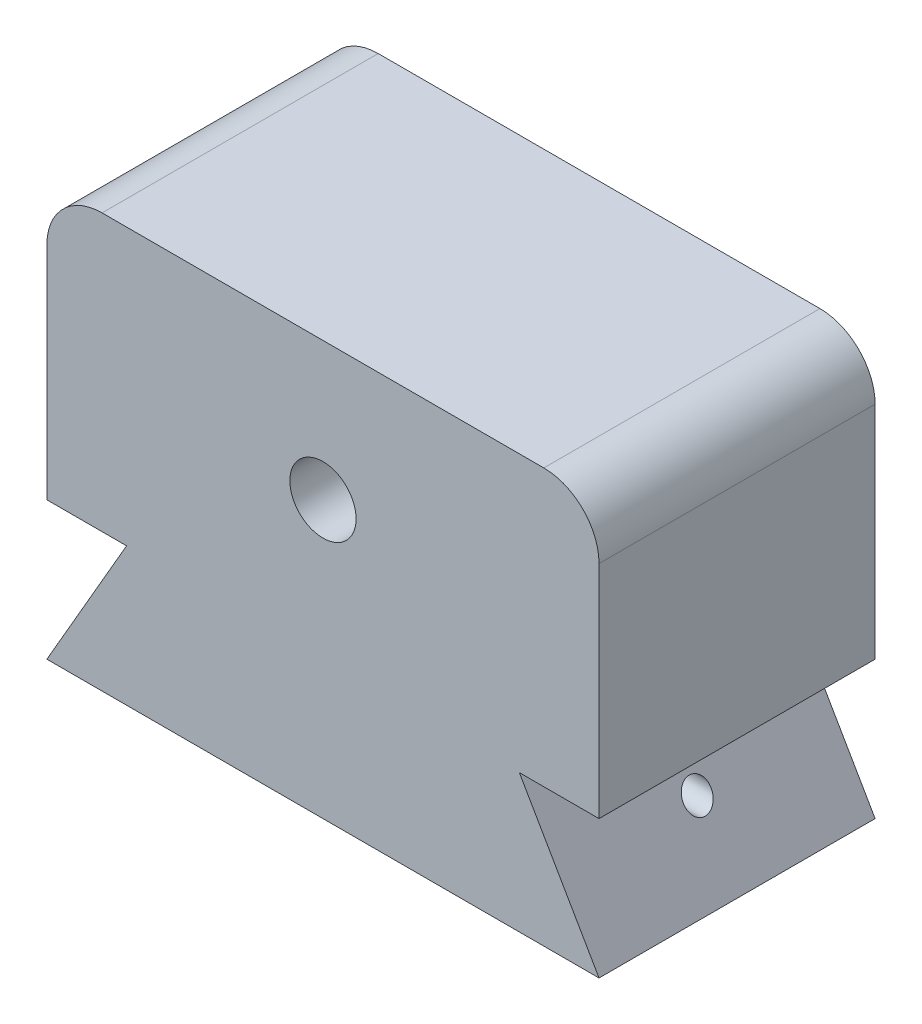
SolidWorks part; units mm, degrees
ref_plane "Front Plane" through (0, 0, 0) normal (0, 0, 1) x (1, 0, 0)
ref_plane "Top Plane" through (0, 0, 0) normal (0, 1, 0) x (1, 0, 0)
ref_plane "Right Plane" through (0, 0, 0) normal (1, 0, 0) x (0, 0, -1)
sketch "Sketch1" plane through (0, 0, 0) normal (0, 0, 1) x (1, 0, 0)
  line L0 (-50, 0) -> (50, 0)
  line L1 (50, 0) -> (35.5662, 25)
  line L2 (35.5662, 25) -> (-35.5662, 25)
  line L3 (-35.5662, 25) -> (-50, 0)
  line L4 (-50, 25) -> (50, 25)
  line L5 (-50, 25) -> (-50, 65)
  line L6 (-40, 75) -> (40, 75)
  line L7 (50, 65) -> (50, 25)
  circle A0 centre (0, 50) radius 6
  arc A1 (50, 65) -> (40, 75) centre (40, 65) ccw
  arc A2 (-50, 65) -> (-40, 75) centre (-40, 65) cw
  point P4 (0, 25)
  point P7 (0, 0)
extrude "Boss-Extrude1" add sketch "Sketch1" along normal blind 50 contours L2 L3 L0 L1 | L7 L6 L5 L4 L2 A0
sketch "Sketch2" plane through (0, 0, 0) normal (0, -1, 0) x (1, 0, 0)
  line L0 (-50, 25) -> (50, 25) construction
  line L1 (-50, 50) -> (-50, 0) construction
  line L2 (50, 50) -> (50, 0) construction
  line L3 (0, 50) -> (0, 0) construction
  line L4 (-50, 50) -> (50, 50) construction
  circle A0 centre (0, 25) radius 6
extrude "Cut-Extrude1" cut sketch "Sketch2" against normal up to surface (25 mm away)
sketch "Sketch3" plane through (0, 0, 0) normal (1, 0, 0) x (0, 0, -1)
  line L0 (-25, -1000) -> (-25, 49000) construction
  line L1 (-50, 0) -> (0, 0) construction
  line L2 (-1050, 12.5) -> (48950, 12.5) construction
  line L3 (-50, 0) -> (-50, 25) construction
  line L4 (-50, 25) -> (0, 25) construction
  circle A0 centre (-25, 12.5) radius 2.5
  point P7 (-25, 0)
  point P13 (-50, 12.5)
  dimension "D1" = 5
  dimension "D2" = 12.5
extrude "Cut-Extrude2" cut sketch "Sketch3" against normal up to surface and the other way up to surface
equation "\"PendulumLength\"= 140mm"
equation "\"EncoderOuterDiameter\"=1.5"
equation "\"EncoderShaftDiameter\"= 6mm"
equation "\"EncoderShaftLength\"=15mm+.5in+3mm"
equation "\"ShaftDiameter\"= 12mm"
equation "\"PendulumHolderangle\"=60"
equation "\"PendulumholderBottomHeight\"= 75"
equation "\"PendulumholderBottomWidth\"= 75"
equation "\"PendulumholderHeight\"=25"
equation "\"BearingOutsideDiameter\"=21mm"
equation "\"D4@Sketch1\"=\"PendulumholderHeight\""
equation "\"D1@Sketch1\"=\"PendulumHolderangle\""
equation "\"PendulumHolderWidth\"= 100mm"
equation "\"D3@Sketch1\"=\"PendulumHolderWidth\""
equation "\"PendulumDiameter\"=12mm"
equation "\"D1@Sketch2\"=\"PendulumDiameter\""
equation "\"D5@Sketch1\"=\"ShaftDiameter\""
